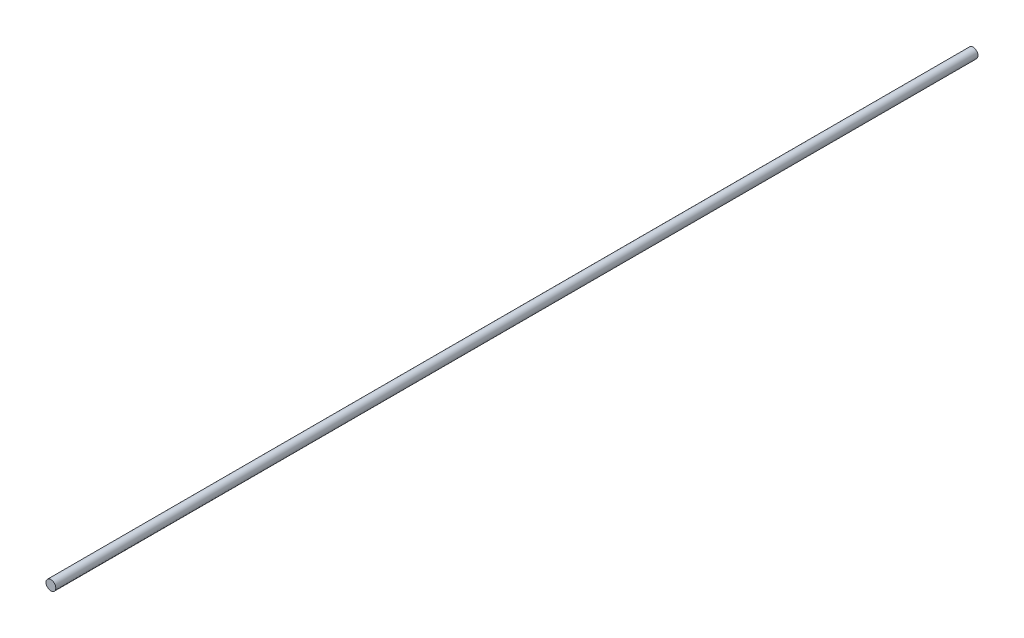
SolidWorks part; units mm, degrees
ref_plane "Front Plane" through (0, 0, 0) normal (0, 0, 1) x (1, 0, 0)
ref_plane "Top Plane" through (0, 0, 0) normal (0, 1, 0) x (1, 0, 0)
ref_plane "Right Plane" through (0, 0, 0) normal (1, 0, 0) x (0, 0, -1)
sketch "Sketch1" plane through (0, 0, 0) normal (0, 0, 1) x (1, 0, 0)
  circle A0 centre (0, 0) radius 30
  dimension "D1" = 60
extrude "Boss-Extrude1" add sketch "Sketch1" against normal blind 5650
